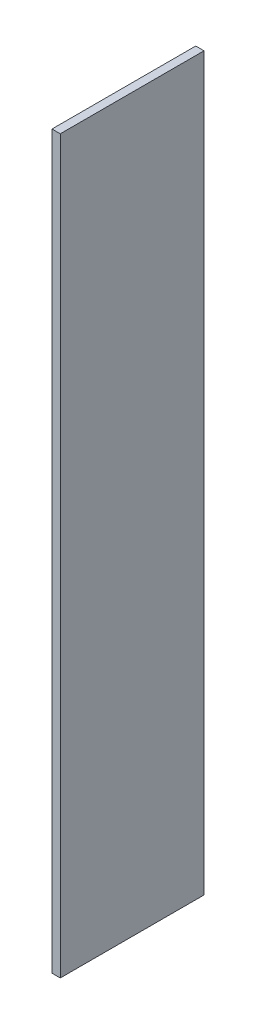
SolidWorks part; units mm, degrees
ref_plane "Front Plane" through (0, 0, 0) normal (0, 0, 1) x (1, 0, 0)
ref_plane "Top Plane" through (0, 0, 0) normal (0, 1, 0) x (1, 0, 0)
ref_plane "Right Plane" through (0, 0, 0) normal (1, 0, 0) x (0, 0, -1)
sketch "Sketch1" plane through (0, 0, 0) normal (1, 0, 0) x (0, 0, -1)
  line L1 (-28.2194, 143.51) -> (28.2194, 143.51)
  line L2 (-28.2194, 143.51) -> (-28.2194, -143.51)
  line L3 (-28.2194, -143.51) -> (28.2194, -143.51)
  line L4 (28.2194, 143.51) -> (28.2194, -143.51)
  line L5 (-28.2194, 143.51) -> (28.2194, -143.51) construction
  line L6 (-28.2194, -143.51) -> (28.2194, 143.51) construction
  point P0 (0, 0)
extrude "Boss-Extrude1" add sketch "Sketch1" along normal blind 3.2512
equation "\"motor offset\"=6mm"
equation "\"thickness0.25\"=0.225in"
equation "\"thickness0.125\"=0.122in"
equation "\"thickness_acrylic0.1\"= 0.1in"
equation "\"D1@Sketch1\"=\"thickness_acrylic0.1\"+\"thickness0.125\"+2"
